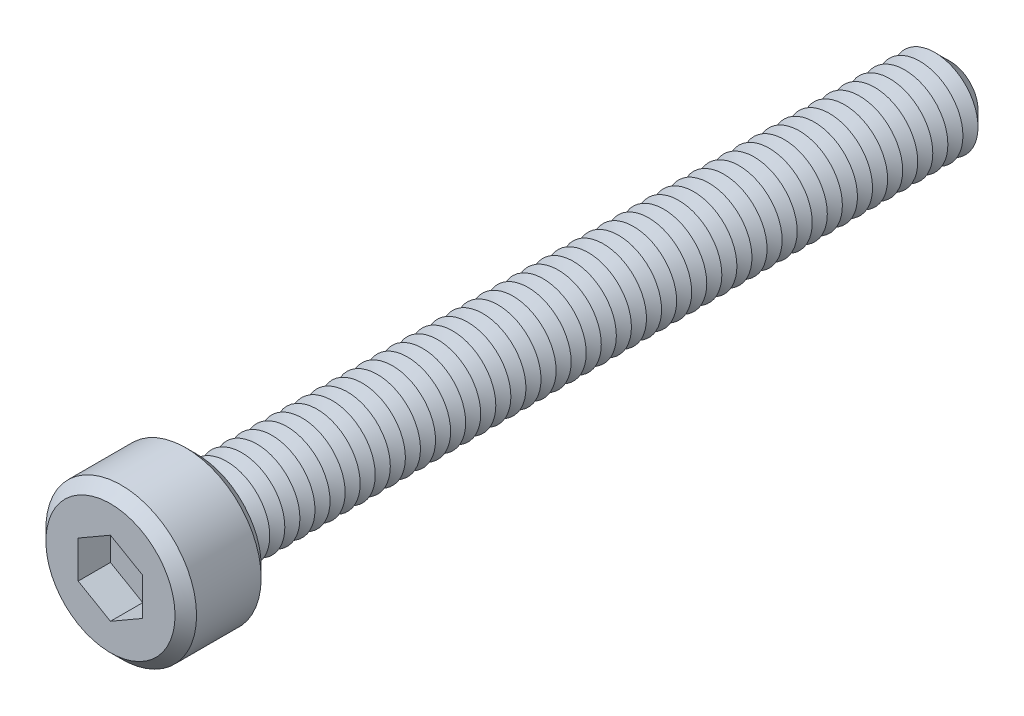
SolidWorks part; units mm, degrees
ref_plane "Front Plane" through (0, 0, 0) normal (0, 0, 1) x (1, 0, 0)
ref_plane "Top Plane" through (0, 0, 0) normal (0, 1, 0) x (1, 0, 0)
ref_plane "Right Plane" through (0, 0, 0) normal (1, 0, 0) x (0, 0, -1)
sketch "Sketch1" plane through (0, 0, 0) normal (0, 0, 1) x (1, 0, 0)
  circle A0 centre (0, 0) radius 3.5
  dimension "D1" = 7
extrude "Boss-Extrude1" add sketch "Sketch1" along normal blind 4
sketch "Sketch2" plane through (0, 0, 0) normal (0, 0, -1) x (-1, 0, 0)
  circle A0 centre (0, 0) radius 2
  dimension "D1" = 4
extrude "Boss-Extrude2" add sketch "Sketch2" along normal blind 35
chamfer "Chamfer1" distance 0.7 angle 45 1 edges at (-2, 0, -35)
sketch "Sketch3" plane through (0, 0, 0) normal (1, 0, 0) x (0, 0, -1)
  line L0 (-2.5121, 0) -> (4.5776, 0) construction
sketch "Sketch4" plane through (0, 0, 0) normal (1, 0, 0) x (0, 0, -1)
  line L0 (0, 2) -> (0.35, 1.3938)
  line L1 (0.35, 1.3938) -> (0.7, 2)
  line L2 (34.3, 2) -> (0, 2) construction
  line L3 (0.7, 2) -> (0, 2)
  dimension "D1" = 0.7
revolve "Cut-Revolve1" cut sketch "Sketch4" angle 360 about L0
pattern_linear "LPattern1" count 49 spacing 0.7 along (0, 0, -1) of "Cut-Revolve1"
sketch "Sketch5" plane through (0, 0, 4) normal (0, 0, 1) x (1, 0, 0)
  line L1 (0, 1.7321) -> (-1.5, 0.866)
  line L2 (-1.5, 0.866) -> (-1.5, -0.866)
  line L3 (-1.5, -0.866) -> (0, -1.7321)
  line L4 (0, -1.7321) -> (1.5, -0.866)
  line L5 (1.5, -0.866) -> (1.5, 0.866)
  line L6 (1.5, 0.866) -> (0, 1.7321)
  circle A0 centre (0, 0) radius 1.5 construction
  dimension "D1" = 3
extrude "Cut-Extrude1" cut sketch "Sketch5" against normal blind 1.5
sketch "Sketch6" plane through (0, 0, 2.5) normal (0, 0, 1) x (1, 0, 0)
  circle A0 centre (0, 0) radius 0.5
  dimension "D1" = 1
extrude "Cut-Extrude2" cut sketch "Sketch6" against normal up to surface (37.5 mm away)
chamfer "Chamfer2" distance 0.5 angle 45 2 edges at (3.5, 0, 0) (3.5, 0, 4)
